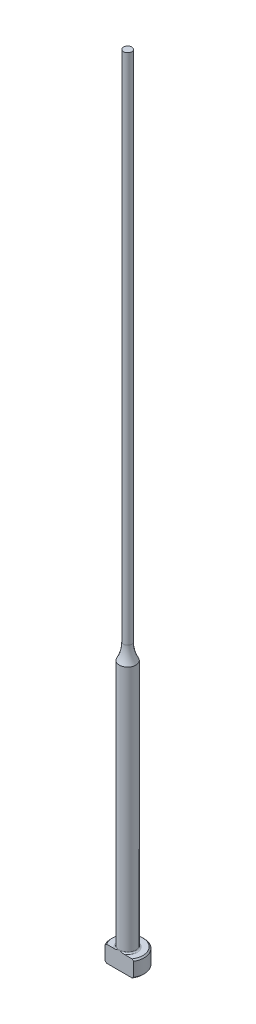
SolidWorks part; units mm, degrees
ref_plane "Front Plane" through (0, 0, 0) normal (0, 0, 1) x (1, 0, 0)
ref_plane "Top Plane" through (0, 0, 0) normal (0, 1, 0) x (1, 0, 0)
ref_plane "Right Plane" through (0, 0, 0) normal (1, 0, 0) x (0, 0, -1)
sketch "Sketch1" plane through (0, 0, 0) normal (0, 0, 1) x (1, 0, 0)
  line L0 (0, 259.9588) -> (0, -15.1925) construction
  line L1 (0, 0) -> (-3.175, 0)
  line L2 (-3.175, 0) -> (-3.175, 3.175)
  line L3 (-3.175, 3.175) -> (-1.5875, 3.175)
  line L4 (-0.7937, 53.8742) -> (-0.7937, 152.4)
  line L5 (-0.7937, 152.4) -> (0, 152.4)
  line L6 (0, 152.4) -> (0, 0)
  line L7 (-1.5875, 3.175) -> (-1.5875, 50.8)
  arc A0 (-1.5875, 50.8) -> (-0.7937, 53.8742) centre (-7.1437, 53.8742) ccw
  point P13 (-1.5875, 0)
  dimension "D1" = 6.35
  dimension "L" = 152.4
  dimension "D2" = 3.175
  dimension "H" = 6.35
  dimension "T" = 3.175
  dimension "D" = 1.5875
  dimension "S" = 50.8
revolve "Revolve1" add sketch "Sketch1" angle 360 about L0
chamfer "Chamfer1" distance 0.254 angle 45 2 edges at (0, 3.175, 3.175) (0, 0, 3.175)
fillet "Fillet1" radius 0.254 1 edges at (0, 3.175, 1.5875)
sketch "Sketch2" plane through (0, 0, 0) normal (0, -1, 0) x (1, 0, 0)
  line L0 (-2.7496, 1.5875) -> (2.7496, 1.5875)
  arc A0 (2.7496, 1.5875) -> (-2.7496, 1.5875) centre (0, 0) ccw
  circle A1 centre (0, 0) radius 3.175 construction
  circle A2 centre (0, 0) radius 1.5875 construction
extrude "Cut-Extrude1" cut sketch "Sketch2" against normal through all
